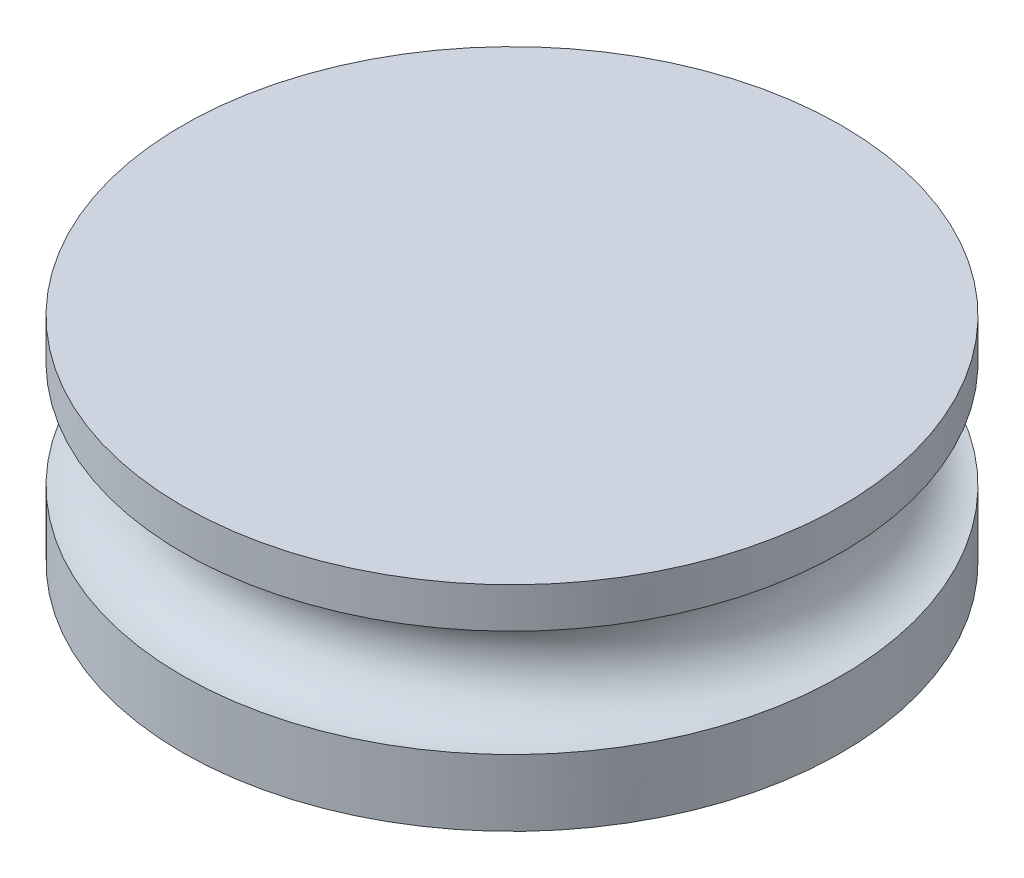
SolidWorks part; units mm, degrees
ref_plane "Front Plane" through (0, 0, 0) normal (0, 0, 1) x (1, 0, 0)
ref_plane "Top Plane" through (0, 0, 0) normal (0, 1, 0) x (1, 0, 0)
ref_plane "Right Plane" through (0, 0, 0) normal (1, 0, 0) x (0, 0, -1)
sketch "Sketch1" plane through (0, 0, 0) normal (0, 1, 0) x (1, 0, 0)
  circle A0 centre (0, 0) radius 78.3646
extrude "Extrude1" add sketch "Sketch1" along normal blind 50.8
sketch "Sketch2" plane through (0, 0, 0) normal (0, 0, 1) x (1, 0, 0)
  line L0 (-78.3646, 50.8) -> (-78.3646, 0) construction
  line L1 (0, 0) -> (0, 71.7084) construction
  line L2 (0, 0) -> (-78.3646, 28.5224) construction
  line L3 (-78.3646, 0) -> (78.3646, 0) construction
  circle A0 centre (-78.3646, 28.5224) radius 12.7
  dimension "D1" = 25.4
  dimension "D2" = 20
revolve "Cut-Revolve1" cut sketch "Sketch2" angle 360 about L1
